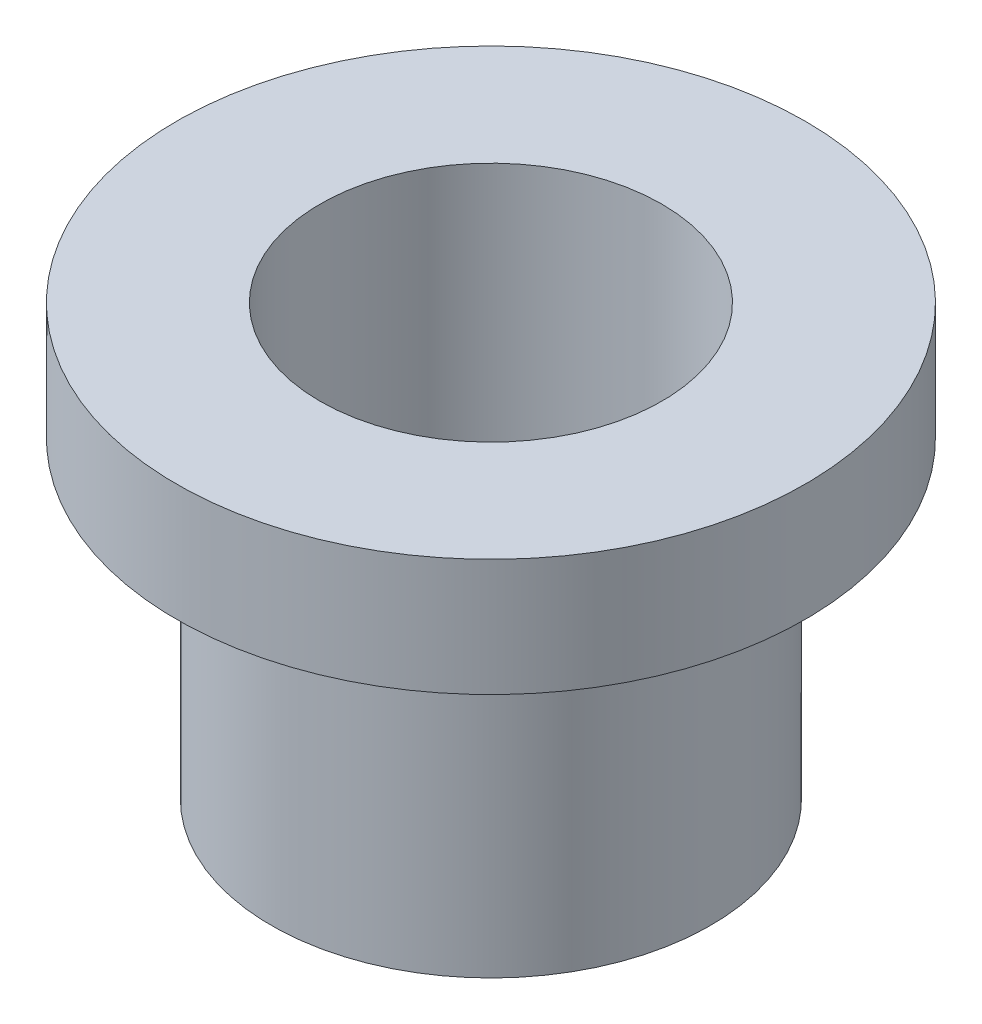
SolidWorks part; units mm, degrees
ref_plane "Front" through (0, 0, 0) normal (0, 0, 1) x (1, 0, 0)
ref_plane "Top" through (0, 0, 0) normal (0, 1, 0) x (1, 0, 0)
ref_plane "Right" through (0, 0, 0) normal (1, 0, 0) x (0, 0, -1)
sketch "Sketch1" plane through (0, 0, 0) normal (0, 0, 1) x (1, 0, 0)
  line L0 (-5.5562, 3.81) -> (-10.2235, 3.81)
  line L1 (-10.2235, 3.81) -> (-10.2235, 0)
  line L2 (-10.2235, 0) -> (-6.35, 0)
  line L3 (-6.35, 0) -> (-6.35, -2.032)
  line L4 (-6.35, -2.032) -> (-7.1437, -2.032)
  line L5 (-7.1437, -2.032) -> (-7.1437, -10.16)
  line L6 (-7.1437, -10.16) -> (-5.5562, -10.16)
  line L7 (-5.5562, -10.16) -> (-5.5562, 3.81)
  line L8 (0, 0) -> (0, 41.9671) construction
  dimension "D1" = 20.447
  dimension "D2" = 12.7
  dimension "D3" = 14.2875
  dimension "D4" = 3.81
  dimension "D5" = 13.97
  dimension "D6" = 2.032
  dimension "D7" = 11.1125
revolve "Revolve1" add sketch "Sketch1" angle 360 about L8
